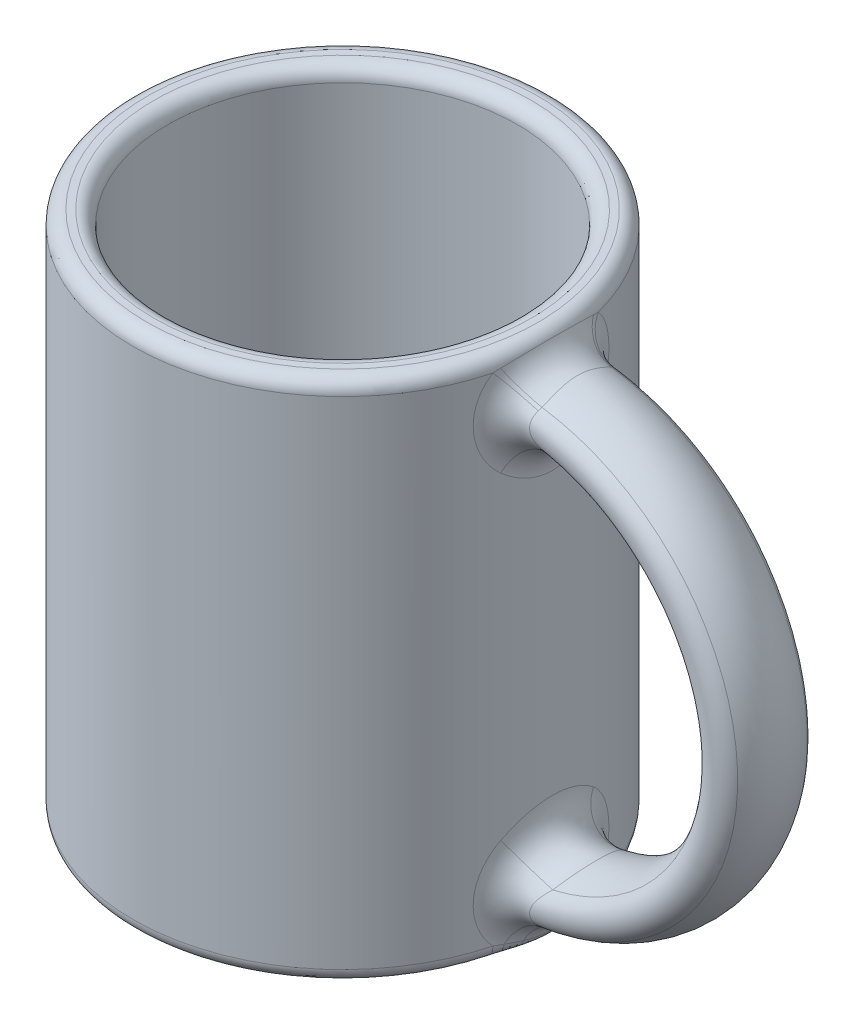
SolidWorks part; units mm, degrees
ref_plane "Plane1" through (0, 0, 0) normal (0, 0, 1) x (1, 0, 0)
ref_plane "Plane2" through (0, 0, 0) normal (0, 1, 0) x (1, 0, 0)
ref_plane "Plane3" through (0, 0, 0) normal (1, 0, 0) x (0, 0, -1)
sketch "Sketch1" plane through (0, 0, 0) normal (0, 1, 0) x (1, 0, 0)
  circle A0 centre (0, 0) radius 38.1
  dimension "mug-diameter" = 76.2
extrude "cylinder" add sketch "Sketch1" along normal blind 95.25
sketch "Sketch5" plane through (0, 0, 0) normal (1, 0, 0) x (0, 0, -1)
  line L0 (-9.525, 85.725) -> (9.525, 85.725) construction
  arc A0 (-6.3252, 88.9033) -> (6.3252, 88.9033) centre (0, 79.3353) cw
  arc A1 (6.3252, 82.5467) -> (-6.3252, 82.5467) centre (0, 92.1147) cw
  arc A2 (-6.3252, 82.5467) -> (-6.3252, 88.9033) centre (-4.2241, 85.725) cw
  arc A3 (6.3252, 88.9033) -> (6.3252, 82.5467) centre (4.2241, 85.725) cw
  dimension "D4" = 10.16
  dimension "D5" = 3.81
  dimension "D3" = 19.05
sketch "Sketch4" plane through (0, 0, 0) normal (0, 0, 1) x (1, 0, 0)
  line L0 (0, 85.725) -> (36.83, 85.725)
  line L1 (0, 95.25) -> (0, 0) construction
  line L2 (36.83, 9.525) -> (0, 9.525)
  arc A0 (36.83, 85.725) -> (36.83, 9.525) centre (36.83, 47.625) cw
  dimension "handle-radius" = 76.2
  dimension "handle-center" = 47.625
  dimension "handle-outside" = 36.83
sweep "handle" add profiles "Sketch5" path "Sketch4"
sketch "Sketch6" plane through (0, 95.25, 0) normal (0, 1, 0) x (-1, 0, 0)
  circle A2 centre (0, 0) radius 31.75
  dimension "cut-diameter" = 63.5
extrude "inside-cut" cut sketch "Sketch6" against normal offset from surface (88.9 mm away) 6.35
fillet "top-fillet" radius 2.54 2 edges at (0, 95.25, 31.75) (0, 95.25, 38.1)
fillet "Fillet1" radius 6.35 8 edges at (37.2435, 9.6183, 8.033) (38.0895, 4.4984, 0.8954) (37.2437, 9.4095, -8.0322) (38.0904, 14.597, -0.8572) (37.2437, 85.8405, 8.0322) (38.0895, 90.7516, -0.8954) (37.2435, 85.6317, -8.033) (38.0904, 80.653, 0.8572)
fillet "bottom-fillet" radius 2.54 5 edges at (38.1, 0, 0) (-38.1, 0, 0) (36.0505, 10.0781, 12.3277)
